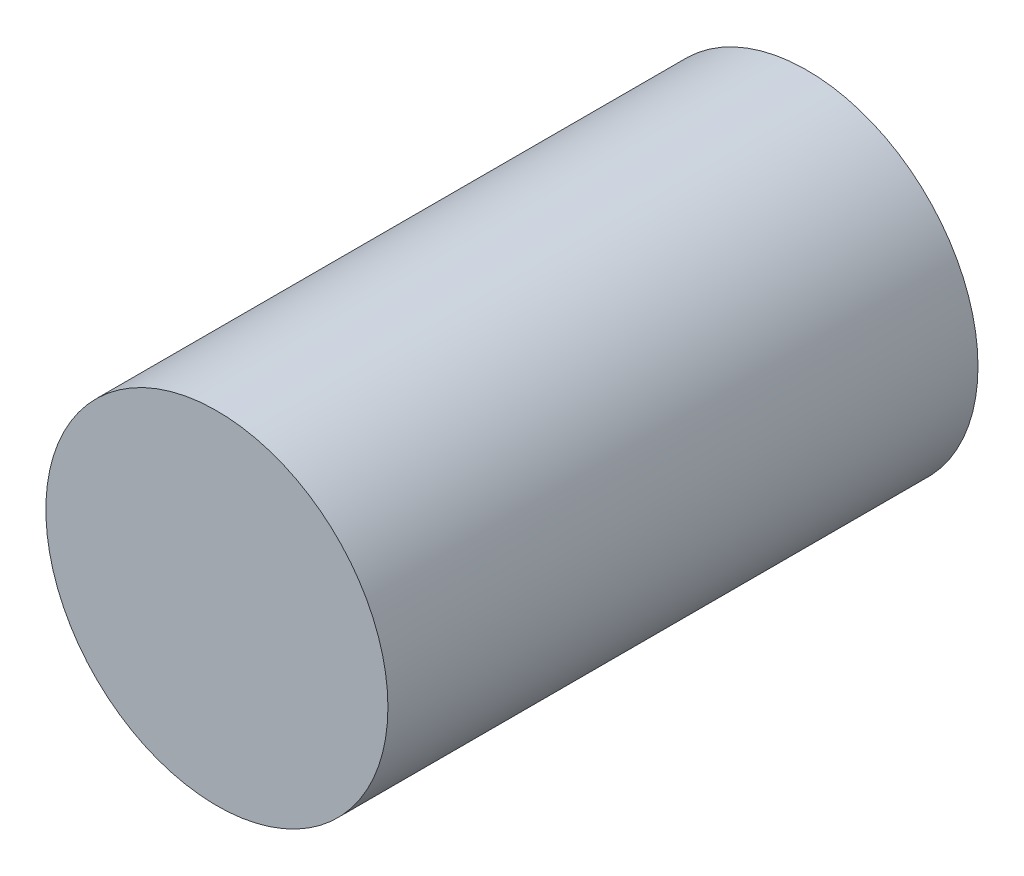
SolidWorks part; units mm, degrees
ref_plane "Face" through (0, 0, 0) normal (0, 0, 1) x (1, 0, 0)
ref_plane "Dessus" through (0, 0, 0) normal (0, 1, 0) x (1, 0, 0)
ref_plane "Droite" through (0, 0, 0) normal (1, 0, 0) x (0, 0, -1)
sketch "EsqCylindre" plane through (0, 0, 0) normal (0, 0, 1) x (1, 0, 0)
  circle A0 centre (0, 0) radius 20
  dimension "Diametre" = 40
extrude "Cylindre" add sketch "EsqCylindre" against normal blind 69
